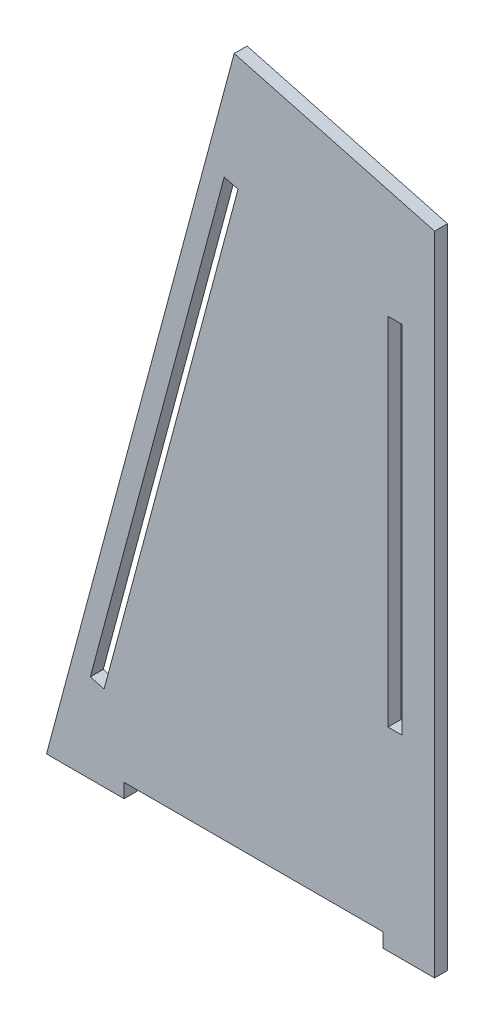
SolidWorks part; units mm, degrees
ref_plane "Front" through (0, 0, 0) normal (0, 0, 1) x (1, 0, 0)
ref_plane "Top" through (0, 0, 0) normal (0, 1, 0) x (1, 0, 0)
ref_plane "Right" through (0, 0, 0) normal (1, 0, 0) x (0, 0, -1)
sketch "草图1" plane through (0, 0, 0) normal (0, 0, 1) x (1, 0, 0)
  line L0 (0, 0) -> (29.0192, 108.3013)
  line L1 (29.0192, 108.3013) -> (60, 100)
  line L2 (60, 100) -> (60, 0)
  line L3 (60, 0) -> (0, 0)
  dimension "D1" = 75
  dimension "D2" = 60
  dimension "D3" = 100
extrude "凸台-拉伸1" add sketch "草图1" along normal blind 2
sketch "草图2" plane through (0, 0, 2) normal (0, 0, 1) x (1, 0, 0)
  line L0 (27.4856, 90.9865) -> (29.6106, 90.4171)
  line L1 (29.6106, 90.4171) -> (8.9051, 13.143)
  line L2 (8.9051, 13.143) -> (6.7801, 13.7124)
  line L3 (6.7801, 13.7124) -> (27.4856, 90.9865)
  line L4 (29.0192, 108.3013) -> (0, 0) construction
  line L5 (0, 0) -> (60, 0) construction
  line L6 (12, 2.2) -> (52, 2.2)
  line L7 (12, 2.2) -> (12, 0)
  line L8 (12, 0) -> (52, 0)
  line L9 (52, 2.2) -> (52, 0)
  line L10 (60, 0) -> (60, 100) construction
  line L12 (52.8, 85) -> (55, 85)
  line L13 (52.8, 85) -> (52.8, 30)
  line L14 (52.8, 30) -> (55, 30)
  line L15 (55, 85) -> (55, 30)
  dimension "D1" = 3
  dimension "D2" = 15
  dimension "D3" = 2.2
  dimension "D4" = 80
  dimension "D5" = 2.2
  dimension "D6" = 40
  dimension "D7" = 0
  dimension "D8" = 8
  dimension "D9" = 5
  dimension "D10" = 2.2
  dimension "D11" = 55
  dimension "D12" = 30
extrude "切除-拉伸1" cut sketch "草图2" against normal blind 2
